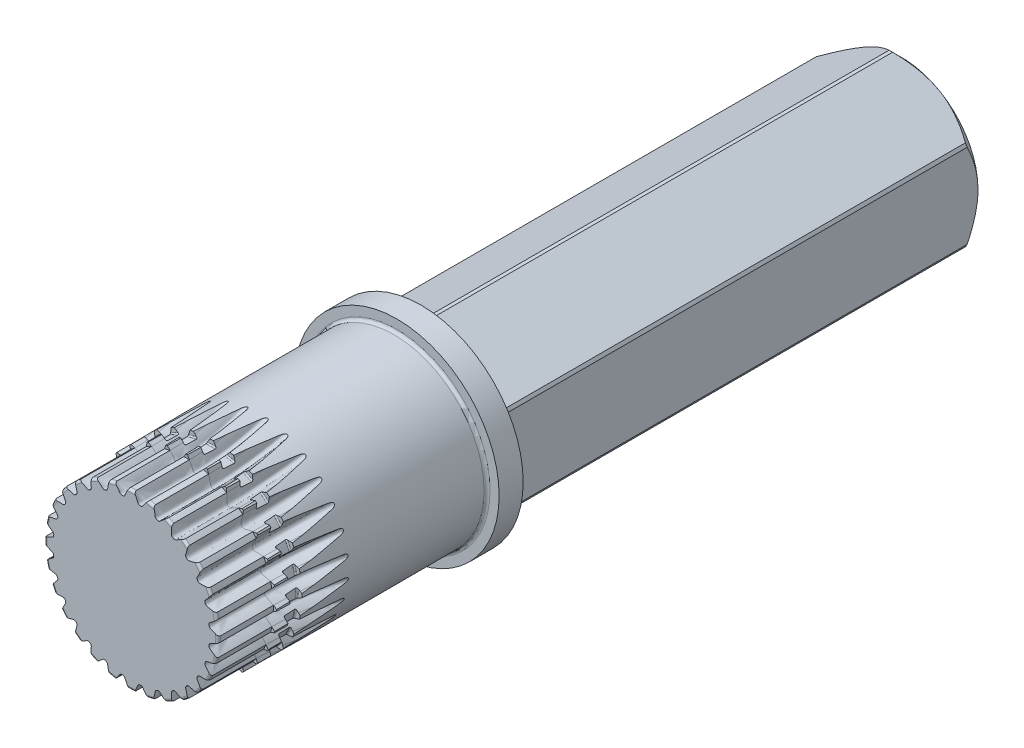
SolidWorks part; units mm, degrees
other "<217-2625-003 Rev1>-<Imported1>"
ref_plane "Front Plane" through (0, 0, 0) normal (0, 0, 1) x (1, 0, 0)
ref_plane "Top Plane" through (0, 0, 0) normal (0, 1, 0) x (1, 0, 0)
ref_plane "Right Plane" through (0, 0, 0) normal (1, 0, 0) x (0, 0, -1)
mirrored part "217-2625-003 Rev1_Mirrored"
